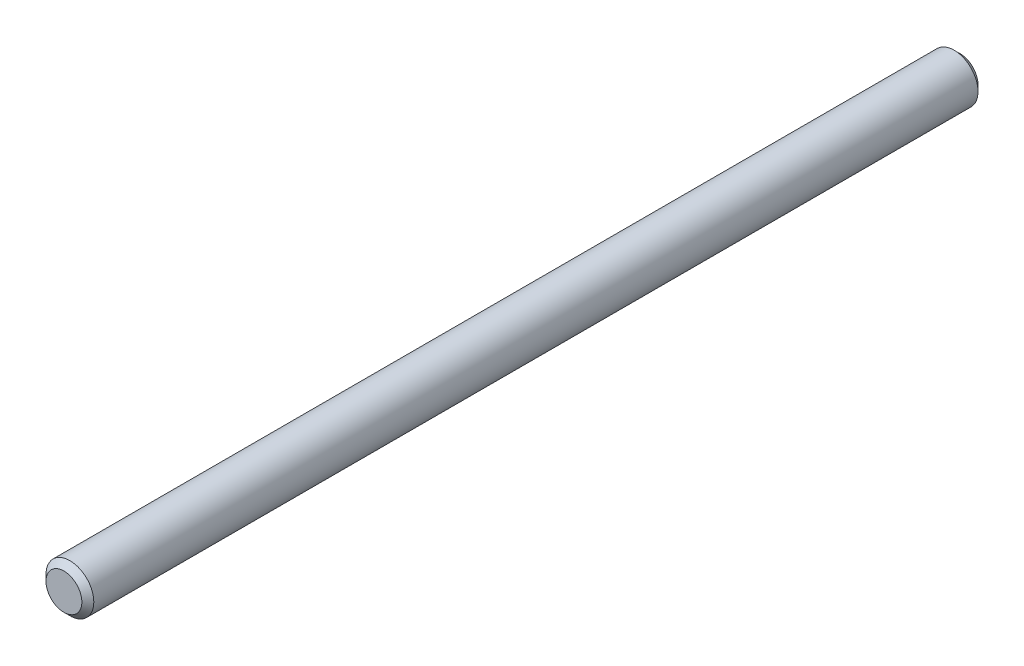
SolidWorks part; units mm, degrees
other "Annotazione1"
sketch "Schizzo6" plane through (4, 4, 0) normal (0.2222, 0.964, -0.1461) x (0.8996, -0.2605, -0.3506)
other "Annotazione2"
sketch "Schizzo7" plane through (4, 4, 0) normal (0.2222, 0.964, -0.1461) x (0.8996, -0.2605, -0.3506)
ref_plane "Piano frontale" through (0, 0, 0) normal (0, 0, 1) x (1, 0, 0)
ref_plane "Piano superiore" through (0, 0, 0) normal (0, 1, 0) x (1, 0, 0)
ref_plane "Piano destro" through (0, 0, 0) normal (1, 0, 0) x (0, 0, -1)
sketch "Schizzo1" plane through (0, 0, 0) normal (0, 0, 1) x (1, 0, 0)
  circle A0 centre (0, 0) radius 4
  dimension "D1" = 8
extrude "Estrusione-Estrusione1" add sketch "Schizzo1" along normal blind 150
chamfer "Smusso1" distance 1 angle 45 2 edges at (4, 0, 150) (4, 0, 0)
